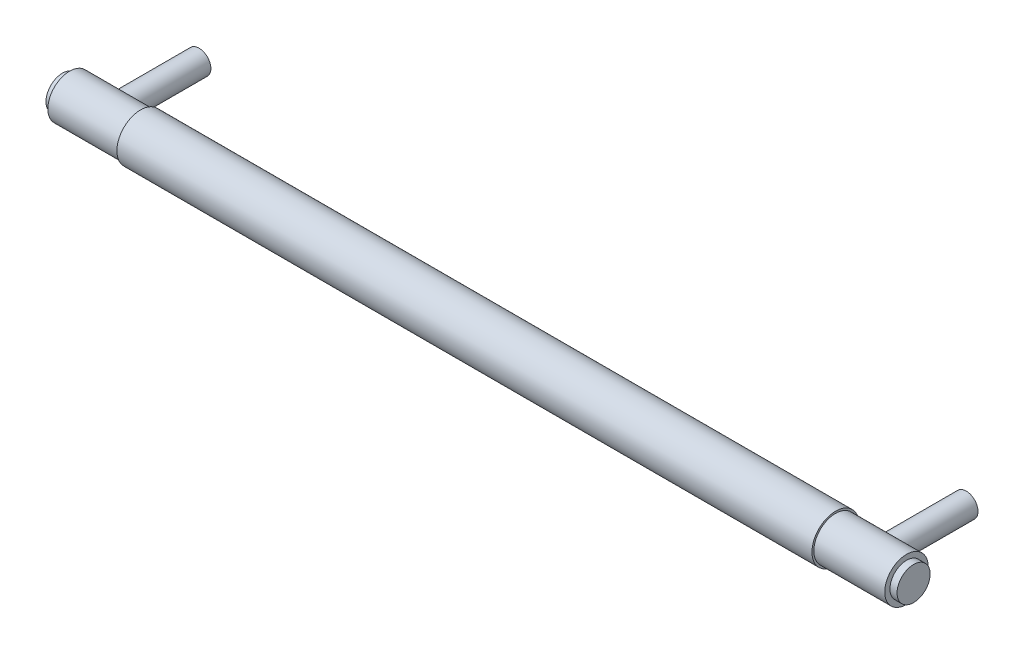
SolidWorks part; units mm, degrees
ref_plane "Front Plane" through (0, 0, 0) normal (0, 0, 1) x (1, 0, 0)
ref_plane "Top Plane" through (0, 0, 0) normal (0, 1, 0) x (1, 0, 0)
ref_plane "Right Plane" through (0, 0, 0) normal (1, 0, 0) x (0, 0, -1)
sketch "Sketch1" plane through (0, 0, 0) normal (1, 0, 0) x (0, 0, -1)
  circle A0 centre (0, 0) radius 10
  dimension "D1" = 20
extrude "Boss-Extrude1" add sketch "Sketch1" along normal blind 147
sketch "Sketch2" plane through (147, 0, 0) normal (1, 0, 0) x (0, 0, -1)
  circle A2 centre (0, 0) radius 9.2
  circle A3 centre (0, 0) radius 9.2
  dimension "D1" = 0.8
extrude "Boss-Extrude3" add sketch "Sketch2" along normal blind 30
sketch "Sketch3" plane through (177, 0, 0) normal (1, 0, 0) x (0, 0, -1)
  circle A0 centre (0, 0) radius 7
extrude "Boss-Extrude4" add sketch "Sketch3" along normal blind 3
mirror "Mirror1" about plane through (0, 0, 0) normal (1, 0, 0) of "Boss-Extrude4", "Boss-Extrude3", "Boss-Extrude1"
sketch "Sketch4" plane through (0, 0, 0) normal (0, 0, 1) x (1, 0, 0)
  line L0 (-180, 0) -> (-167.25, 0) construction
  line L1 (-180, 7) -> (-180, -7) construction
  line L2 (-167.25, 0) -> (-157.25, 0) construction
  line L3 (-162.25, 0) -> (-180, 0) construction
  circle A0 centre (-162.25, 0) radius 5
  dimension "D2" = 10
  dimension "D1" = 17.75
extrude "Boss-Extrude5" add sketch "Sketch4" against normal blind 40
mirror "Mirror2" about plane through (0, 0, 0) normal (1, 0, 0) of "Boss-Extrude5"
sketch "Sketch9" [suppressed] plane through (0, 0, 0) normal (1, 0, 0) x (0, 0, -1)
  line L2 (40, -11.5) -> (40, 11.5)
  line L3 (40, 11.5) -> (43, 11.5)
  line L4 (43, -11.5) -> (43, 11.5)
  line L5 (40, -11.5) -> (43, -11.5)
extrude "Boss-Extrude8" [suppressed] add sketch "Sketch9" along normal mid plane 400
sketch "Sketch10" [suppressed] plane through (0, 0, -40) normal (0, 0, 1) x (1, 0, 0)
  line L0 (0, 0) -> (190, 0) construction
  line L1 (200, 11.5) -> (200, -11.5) construction
  circle A0 centre (190, 0) radius 5
  point P4 (200, 0)
  dimension "D1" = 10
  dimension "D2" = 10
extrude "Boss-Extrude9" [suppressed] add sketch "Sketch10" along normal blind 3 contours A0
sketch "Sketch11" [suppressed] plane through (0, 0, 0) normal (0, 1, 0) x (1, 0, 0)
  line L0 (190, 37) -> (190, 38.5) construction
  line L1 (185, 37) -> (195, 37) construction
  line L2 (185, 37) -> (186, 37) construction
  line L3 (195, 37) -> (194, 37) construction
  line L6 (186, 37) -> (186, 34.6346)
  line L7 (186, 34.6346) -> (194, 34.6346)
  line L8 (194, 37) -> (194, 34.6346)
  arc A0 (186, 37) -> (194, 37) centre (190, 32.5279) cw
  dimension "D3" = 6
  dimension "D1" = 1
  dimension "D2" = 1
extrude "Cut-Extrude1" [suppressed] cut sketch "Sketch11" against normal mid plane 2
mirror "Mirror3" [suppressed] about plane through (0, 0, 0) normal (1, 0, 0)
sketch "Sketch13" [suppressed] plane through (0, 0, -40) normal (0, 0, -1) x (-1, 0, 0)
  circle A0 centre (-362.25, 0) radius 12
  dimension "D1" = 24
extrude "Boss-Extrude10" [suppressed] add sketch "Sketch13" along normal blind 3
mirror "Mirror4" [suppressed] about plane through (0, 0, 0) normal (1, 0, 0)
